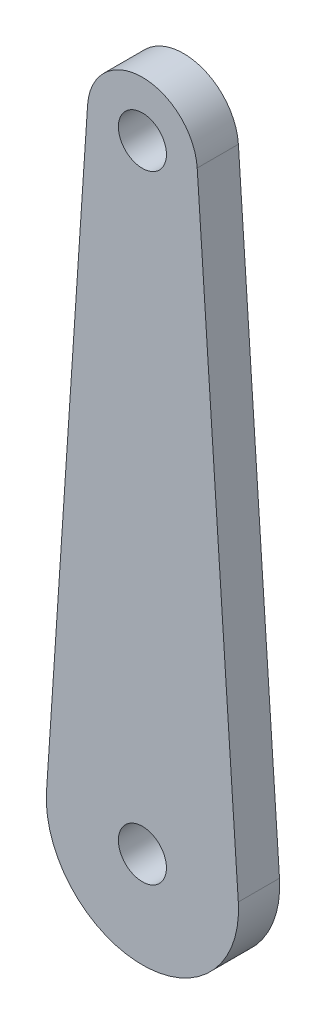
SolidWorks part; units mm, degrees
ref_plane "Front Plane" through (0, 0, 0) normal (0, 0, 1) x (1, 0, 0)
ref_plane "Top Plane" through (0, 0, 0) normal (0, 1, 0) x (1, 0, 0)
ref_plane "Right Plane" through (0, 0, 0) normal (1, 0, 0) x (0, 0, -1)
sketch "Sketch1" plane through (0, 0, 0) normal (0, 0, 1) x (1, 0, 0)
  line L0 (0, 0) -> (0, 45) construction
  line L1 (-3.9911, 45.2667) -> (-6.9844, 0.4667)
  line L2 (3.9911, 45.2667) -> (6.9844, 0.4667)
  circle A0 centre (0, 0) radius 1.75
  arc A1 (-6.9844, 0.4667) -> (6.9844, 0.4667) centre (0, 0) ccw
  circle A2 centre (0, 45) radius 1.75
  arc A3 (3.9911, 45.2667) -> (-3.9911, 45.2667) centre (0, 45) ccw
  dimension "D1" = 45
  dimension "D2" = 3.5
  dimension "D3" = 3.5
  dimension "D4" = 14
  dimension "D5" = 8
extrude "Extrude1" add sketch "Sketch1" along normal blind 3
